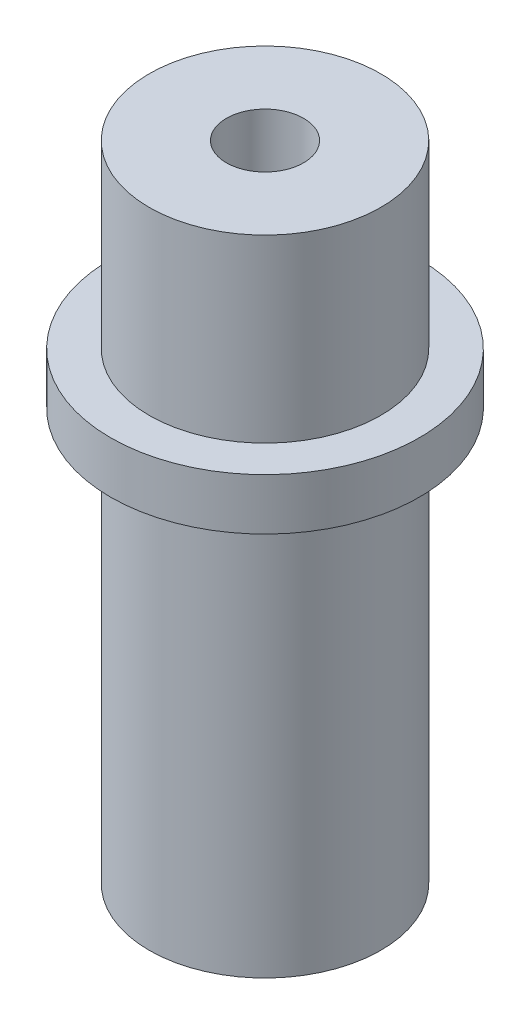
SolidWorks part; units mm, degrees
ref_plane "Front Plane" through (0, 0, 0) normal (0, 0, 1) x (1, 0, 0)
ref_plane "Top Plane" through (0, 0, 0) normal (0, 1, 0) x (1, 0, 0)
ref_plane "Right Plane" through (0, 0, 0) normal (1, 0, 0) x (0, 0, -1)
sketch "Sketch1" plane through (0, 0, 0) normal (0, 1, 0) x (1, 0, 0)
  circle A0 centre (0, 0) radius 5.625
  dimension "D1" = 11.25
extrude "Boss-Extrude1" add sketch "Sketch1" along normal blind 31.25
sketch "Sketch2" plane through (0, 31.25, 0) normal (0, 1, 0) x (1, 0, 0)
  circle A0 centre (0, 0) radius 1.875
  dimension "D1" = 3.75
extrude "Cut-Extrude1" cut sketch "Sketch2" against normal blind 21.75
sketch "Sketch3" plane through (0, 0, 0) normal (0, -1, 0) x (1, 0, 0)
  circle A0 centre (0, 0) radius 1.25
  dimension "D1" = 2.5
extrude "Cut-Extrude2" cut sketch "Sketch3" against normal blind 9.5
ref_plane "Plane1" through (0, 20, 0) normal (0, 1, 0) x (1, 0, 0)
sketch "Sketch4" plane through (0, 20, 0) normal (0, 1, 0) x (1, 0, 0)
  circle A0 centre (0, 0) radius 7.5
  circle A1 centre (0, 0) radius 5.625 construction
  circle A2 centre (0, 0) radius 5.625
  dimension "D1" = 15
extrude "Boss-Extrude2" add sketch "Sketch4" along normal blind 2.5
